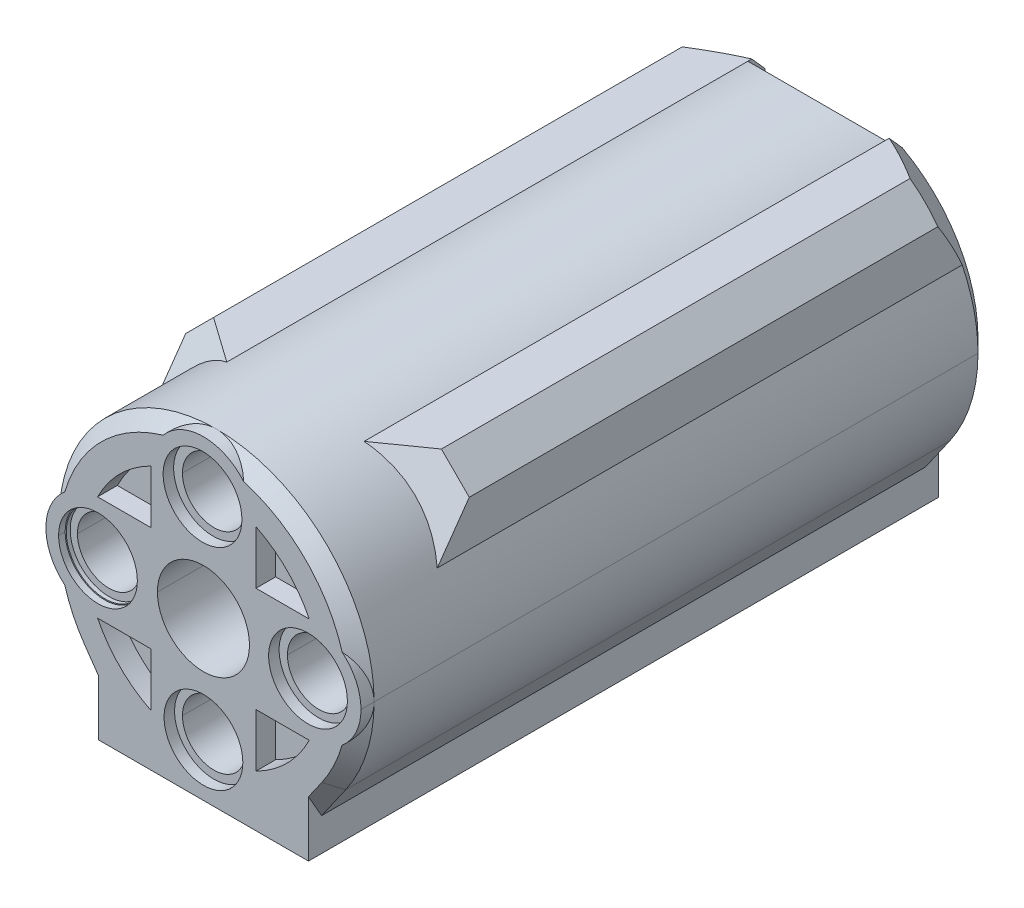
SolidWorks part; units mm, degrees
ref_plane "Front Plane" through (0, 0, 0) normal (0, 0, 1) x (1, 0, 0)
ref_plane "Top Plane" through (0, 0, 0) normal (0, 1, 0) x (1, 0, 0)
ref_plane "Right Plane" through (0, 0, 0) normal (1, 0, 0) x (0, 0, -1)
imported_body "Motor 9V  PF Medium.STEP"
sketch "Sketch1" plane through (0, -12, 0) normal (0, -1, 0) x (1, 0, 0)
  line L1 (-8, 24) -> (8, 24)
  line L2 (-8, 24) -> (-8, -24)
  line L3 (-8, -24) -> (8, -24)
  line L4 (8, 24) -> (8, -24)
extrude "Boss-Extrude1" add sketch "Sketch1" against normal up to surface (1.9 mm away)
sketch "Sketch3" plane through (0, 0, 24) normal (0, 0, 1) x (1, 0, 0)
  circle A0 centre (0, -8) radius 2.4
extrude "Cut-Extrude1" cut sketch "Sketch3" against normal up to surface (8.5 mm away)
sketch "Sketch4" plane through (0, 0, 24) normal (0, 0, 1) x (1, 0, 0)
  circle A0 centre (0, -8) radius 3
extrude "Cut-Extrude2" cut sketch "Sketch4" against normal up to surface (0.5 mm away)
sketch "Sketch6" plane through (0, -12, 0) normal (0, -1, 0) x (1, 0, 0)
  line L0 (-6.3322, 22.503) -> (-1.5322, 22.503)
  line L1 (-6.3322, 22.503) -> (-6.3322, -22.297)
  line L2 (-6.3322, -22.297) -> (-1.5322, -22.297)
  line L3 (6.4678, 22.503) -> (6.4678, -22.297)
  line L4 (-1.5322, 22.503) -> (-1.5322, -22.297)
  line L5 (1.6678, -22.297) -> (1.6678, 22.503)
  line L6 (-3.9322, 16.103) -> (-3.9322, 8.103) construction
  line L7 (1.6678, 22.503) -> (6.4678, 22.503)
  line L8 (1.6678, -22.297) -> (6.4678, -22.297)
  circle A0 centre (-3.9322, 16.103) radius 1.6
  circle A1 centre (4.0678, 16.103) radius 1.6
  circle A2 centre (-3.9322, 8.103) radius 1.6
  circle A3 centre (4.0678, 8.103) radius 1.6
  circle A4 centre (-3.9322, 0.103) radius 1.6
  circle A5 centre (4.0678, 0.103) radius 1.6
  circle A6 centre (-3.9322, -7.897) radius 1.6
  circle A7 centre (4.0678, -7.897) radius 1.6
  circle A8 centre (-3.9322, -15.897) radius 1.6
  circle A9 centre (4.0678, -15.897) radius 1.6
  dimension "D1" = 2.4
  dimension "D2" = 6.4
  dimension "D3" = 2.4
  dimension "D4" = 4.8
  dimension "D5" = 4.8
  dimension "D6" = 6.4
  dimension "D7" = 8
extrude "Cut-Extrude5" cut sketch "Sketch6" against normal blind 1.6
sketch "Sketch7" plane through (0, 0, 24) normal (0, 0, 1) x (1, 0, 0)
  circle A0 centre (-0.07, 8) radius 3
  circle A1 centre (7.965, 0.035) radius 3
  circle A2 centre (-8, 0) radius 2.9505
  circle A3 centre (0, -8) radius 3
extrude "Cut-Extrude6" cut sketch "Sketch7" against normal blind 0.8
